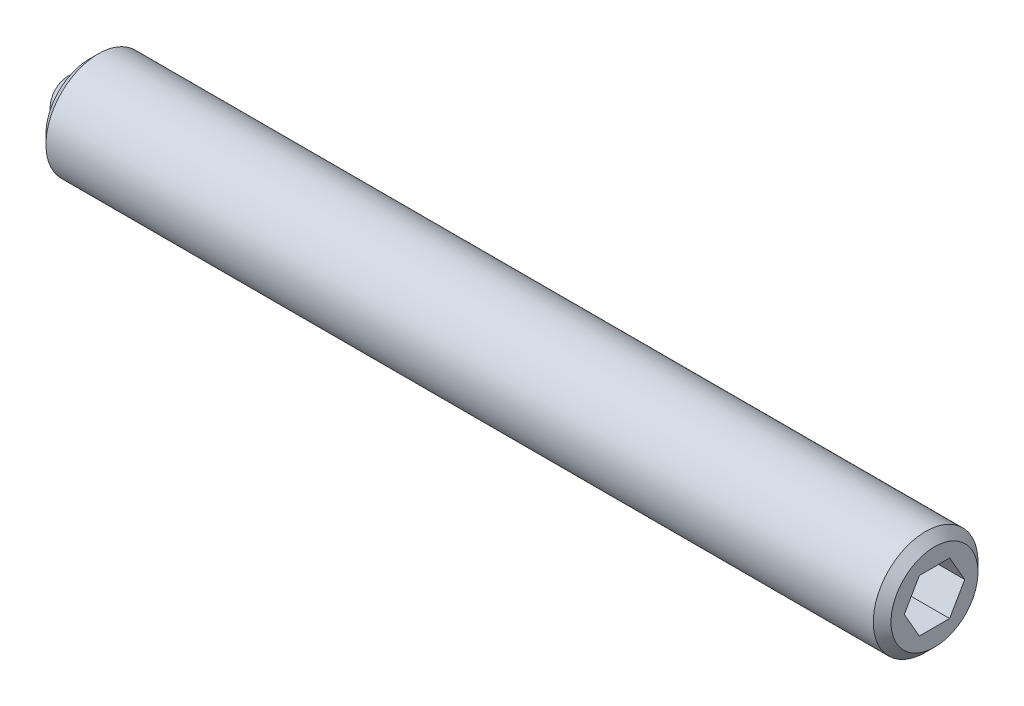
SolidWorks part; units mm, degrees
ref_plane "Front Plane" through (0, 0, 0) normal (0, 0, 1) x (1, 0, 0)
ref_plane "Top Plane" through (0, 0, 0) normal (0, 1, 0) x (1, 0, 0)
ref_plane "Right Plane" through (0, 0, 0) normal (1, 0, 0) x (0, 0, -1)
sketch "Sketch2" plane through (0, 0, 0) normal (1, 0, 0) x (0, 0, -1)
  circle A0 centre (0, 0) radius 1.5
  dimension "D1" = 3
extrude "Boss-Extrude1" add sketch "Sketch2" along normal blind 24.2
sketch "Sketch3" plane through (0, 0, 0) normal (-1, 0, 0) x (0, 0, 1)
  circle A0 centre (0, 0) radius 0.8
  dimension "D1" = 1.6
chamfer "Chamfer1" distance 0.254 angle 45 1 edges at (0, 0, -1.5)
chamfer "Chamfer2" distance 0.254 angle 45 1 edges at (24.2, 0, -1.5)
sketch "Sketch4" plane through (24.2, 0, 0) normal (1, 0, 0) x (0, 0, -1)
  line L1 (0.866, 0) -> (0.433, 0.75)
  line L2 (0.433, 0.75) -> (-0.433, 0.75)
  line L3 (-0.433, 0.75) -> (-0.866, 0)
  line L4 (-0.866, 0) -> (-0.433, -0.75)
  line L5 (-0.433, -0.75) -> (0.433, -0.75)
  line L6 (0.433, -0.75) -> (0.866, 0)
  circle A0 centre (0, 0) radius 0.75 construction
  dimension "D1" = 1.5
extrude "Cut-Extrude2" cut sketch "Sketch4" against normal blind 2
extrude "Cut-Extrude3" cut sketch "Sketch3" against normal blind 0.8
sketch "Sketch5" plane through (0, 0, 0) normal (-1, 0, 0) x (0, 0, 1)
  line L0 (0, 0) -> (0, -0.8)
  line L1 (0, 0) -> (0, 0.8)
  arc A0 (0, 0.8) -> (0, -0.8) centre (0, 0) ccw
  dimension "D1" = 0.8
revolve "Revolve1" add sketch "Sketch5" angle 360 about L1
sketch "Sketch7" plane through (0, 0, 0) normal (-1, 0, 0) x (0, 0, 1)
  line L0 (0, 0) -> (0, 0.8) construction
  arc A0 (0.0634, 0.7975) -> (-0.0634, 0.7975) centre (0, 0) ccw
  arc A1 (0.0634, 0.7975) -> (-0.0634, 0.7975) centre (0, 0.8) ccw
  dimension "D1" = 1.6
  dimension "D2" = 0.127
extrude "Cut-Extrude4" cut sketch "Sketch7" against normal up to surface (0.8 mm away) contours A1 A0
